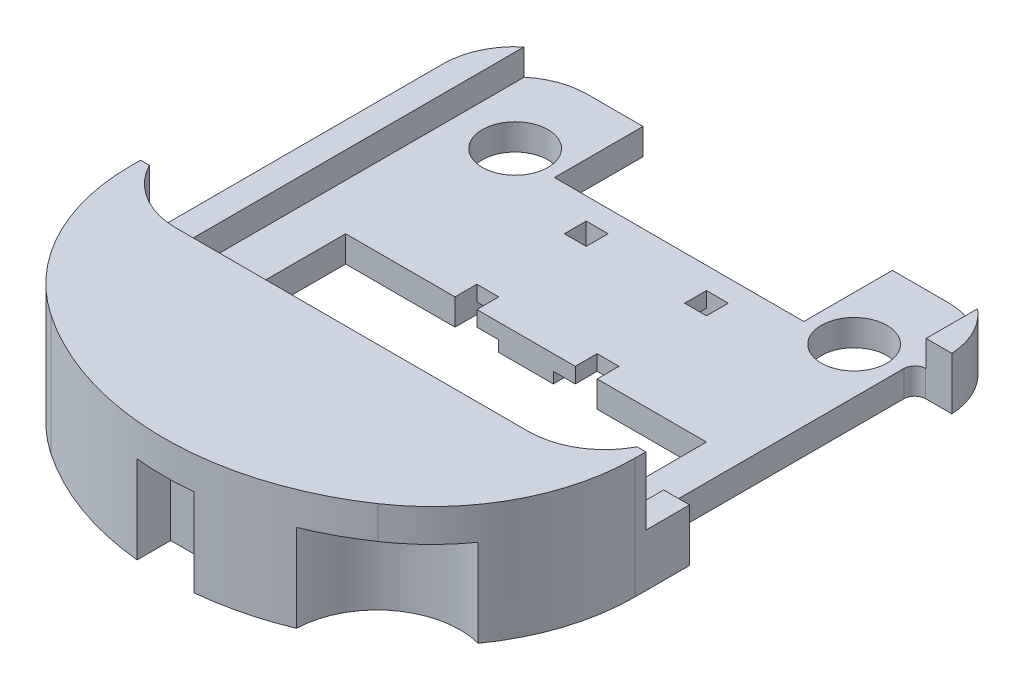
SolidWorks part; units mm, degrees
other "<拾色手电主体（1）>-<凸台-拉伸6>"
ref_plane "前视基准面" through (0, 0, 0) normal (0, 0, 1) x (1, 0, 0)
ref_plane "上视基准面" through (0, 0, 0) normal (0, 1, 0) x (1, 0, 0)
ref_plane "右视基准面" through (0, 0, 0) normal (1, 0, 0) x (0, 0, -1)
inserted part "拾色手电主体（1）"
ref_plane "基准面2" through (0, 9.5933, 0) normal (0, 1, 0) x (1, 0, 0)
sketch "草图3" plane through (0, 9.5933, 0) normal (0, 1, 0) x (1, 0, 0)
  line L0 (112.5486, 176.5566) -> (96.0486, 176.5566) construction
  line L1 (92.5486, 173.0566) -> (92.5486, 158.7494) construction
  line L2 (116.0486, 158.7494) -> (116.0486, 173.0566) construction
  line L3 (112.5486, 176.5566) -> (96.0486, 176.5566) construction
  line L4 (92.5486, 173.0566) -> (92.5486, 158.7494) construction
  line L5 (116.0486, 158.7494) -> (116.0486, 173.0566) construction
  line L6 (108.7986, 175.3066) -> (108.7986, 176.5566) construction
  line L7 (108.7986, 175.3066) -> (99.7986, 175.3066) construction
  line L8 (99.7986, 175.3066) -> (99.7986, 176.5566) construction
  line L12 (108.7986, 175.3066) -> (108.7986, 176.5566) construction
  line L13 (108.7986, 175.3066) -> (99.7986, 175.3066) construction
  line L14 (99.7986, 175.3066) -> (99.7986, 176.5566) construction
  line L15 (105.2986, 148.5937) -> (105.2986, 150.0566) construction
  line L16 (105.2986, 150.0566) -> (103.2986, 150.0566) construction
  line L17 (103.2986, 150.0566) -> (103.2986, 148.5937) construction
  circle A0 centre (104.2986, 168.3066) radius 4 construction
  circle A1 centre (112.0486, 172.5566) radius 2 construction
  circle A2 centre (96.5486, 172.5566) radius 2 construction
  arc A3 (96.0486, 176.5566) -> (92.5486, 173.0566) centre (96.0486, 173.0566) ccw construction
  arc A4 (92.5486, 158.7494) -> (96.7049, 150.8948) centre (102.0486, 158.7494) ccw construction
  arc A5 (96.7049, 150.8948) -> (111.8924, 150.8948) centre (104.2986, 162.0566) ccw construction
  arc A6 (111.8924, 150.8948) -> (116.0486, 158.7494) centre (106.5486, 158.7494) ccw construction
  arc A7 (116.0486, 173.0566) -> (112.5486, 176.5566) centre (112.5486, 173.0566) ccw construction
  circle A8 centre (104.2986, 168.3066) radius 4 construction
  circle A9 centre (112.0486, 172.5566) radius 2 construction
  circle A10 centre (96.5486, 172.5566) radius 2 construction
  arc A11 (96.0486, 176.5566) -> (92.5486, 173.0566) centre (96.0486, 173.0566) ccw construction
  arc A12 (92.5486, 158.7494) -> (96.7049, 150.8948) centre (102.0486, 158.7494) ccw construction
  arc A13 (96.7049, 150.8948) -> (111.8924, 150.8948) centre (104.2986, 162.0566) ccw construction
  arc A14 (111.8924, 150.8948) -> (116.0486, 158.7494) centre (106.5486, 158.7494) ccw construction
  arc A15 (116.0486, 173.0566) -> (112.5486, 176.5566) centre (112.5486, 173.0566) ccw construction
  arc A16 (115.0456, 152.5808) -> (109.7951, 148.6388) centre (113.1491, 149.6392) ccw construction
  arc A17 (115.0456, 152.5808) -> (109.7951, 148.6388) centre (113.1491, 149.6392) ccw construction
sketch "草图4" plane through (0, 9.5933, 0) normal (0, 1, 0) x (1, 0, 0)
  line L0 (92.5486, 173.0566) -> (92.5486, 158.7494) construction
  line L1 (116.0486, 158.7494) -> (116.0486, 173.0566) construction
  line L2 (112.5486, 176.5566) -> (96.0486, 176.5566) construction
  line L3 (92.5486, 173.0566) -> (92.5486, 158.7494) construction
  line L4 (116.0486, 158.7494) -> (116.0486, 173.0566) construction
  line L5 (112.5486, 176.5566) -> (96.0486, 176.5566) construction
  line L6 (92.7486, 173.0566) -> (92.7486, 158.7494)
  line L7 (115.8486, 158.7494) -> (115.8486, 173.0566)
  line L8 (112.5486, 176.3566) -> (96.0486, 176.3566)
  arc A0 (92.5486, 158.7494) -> (96.7049, 150.8948) centre (102.0486, 158.7494) ccw construction
  arc A1 (96.7049, 150.8948) -> (111.8924, 150.8948) centre (104.2986, 162.0566) ccw construction
  arc A2 (111.8924, 150.8948) -> (116.0486, 158.7494) centre (106.5486, 158.7494) ccw construction
  arc A3 (116.0486, 173.0566) -> (112.5486, 176.5566) centre (112.5486, 173.0566) ccw construction
  arc A4 (96.0486, 176.5566) -> (92.5486, 173.0566) centre (96.0486, 173.0566) ccw construction
  arc A5 (92.5486, 158.7494) -> (96.7049, 150.8948) centre (102.0486, 158.7494) ccw construction
  arc A6 (96.7049, 150.8948) -> (111.8924, 150.8948) centre (104.2986, 162.0566) ccw construction
  arc A7 (111.8924, 150.8948) -> (116.0486, 158.7494) centre (106.5486, 158.7494) ccw construction
  arc A8 (116.0486, 173.0566) -> (112.5486, 176.5566) centre (112.5486, 173.0566) ccw construction
  arc A9 (96.0486, 176.5566) -> (92.5486, 173.0566) centre (96.0486, 173.0566) ccw construction
  arc A10 (96.0486, 176.3566) -> (92.7486, 173.0566) centre (96.0486, 173.0566) ccw
  arc A11 (92.7486, 158.7494) -> (96.8174, 151.0602) centre (102.0486, 158.7494) ccw
  arc A12 (96.8174, 151.0602) -> (111.7799, 151.0602) centre (104.2986, 162.0566) ccw
  arc A13 (111.7799, 151.0602) -> (115.8486, 158.7494) centre (106.5486, 158.7494) ccw
  arc A14 (115.8486, 173.0566) -> (112.5486, 176.3566) centre (112.5486, 173.0566) ccw
  dimension "D1" = 0.2
extrude "凸台-拉伸1" add sketch "草图4" along normal blind 5.5 separate body
sketch "草图5" plane through (0, 15.0933, 0) normal (0, 1, 0) x (1, 0, 0)
  circle A0 centre (96.5486, 172.5566) radius 1.5
  circle A1 centre (112.0486, 172.5566) radius 1.5
  dimension "D1" = 3
  dimension "D2" = 3
extrude "切除-拉伸1" cut sketch "草图5" against normal up to next
sketch "草图6" plane through (0, 15.0933, 0) normal (0, 1, 0) x (1, 0, 0)
  line L0 (115.8486, 158.7494) -> (115.8486, 173.0566) construction
  line L3 (96.2486, 157.3566) -> (112.3486, 157.3566)
  line L5 (112.5486, 176.3566) -> (96.0486, 176.3566) construction
  line L6 (92.7486, 173.0566) -> (92.7486, 158.7494) construction
  line L8 (115.8486, 160.8566) -> (115.8486, 173.0566)
  line L9 (112.5486, 176.3566) -> (96.0486, 176.3566)
  line L10 (92.7486, 173.0566) -> (92.7486, 160.8566)
  arc A0 (92.7486, 160.8566) -> (96.2486, 157.3566) centre (96.2486, 160.8566) ccw
  arc A1 (112.3486, 157.3566) -> (115.8486, 160.8566) centre (112.3486, 160.8566) ccw
  arc A4 (115.8486, 173.0566) -> (112.5486, 176.3566) centre (112.5486, 173.0566) ccw construction
  arc A5 (96.0486, 176.3566) -> (92.7486, 173.0566) centre (96.0486, 173.0566) ccw construction
  arc A6 (115.8486, 173.0566) -> (112.5486, 176.3566) centre (112.5486, 173.0566) ccw
  arc A7 (96.0486, 176.3566) -> (92.7486, 173.0566) centre (96.0486, 173.0566) ccw
  point P0 (104.2986, 166.8566)
  dimension "D4" = 3.5
extrude "切除-拉伸2" cut sketch "草图6" against normal blind 4.3
sketch "草图7" plane through (0, 10.7933, 0) normal (0, 1, 0) x (1, 0, 0)
  line L0 (92.7486, 173.0566) -> (92.7486, 160.8566)
  line L3 (93.9314, 172.8538) -> (93.9314, 158.384)
  line L5 (93.9314, 158.384) -> (93.9314, 158.2336)
  line L6 (93.9314, 172.8538) -> (93.9314, 175.5879)
  arc A1 (92.7486, 160.8566) -> (96.2486, 157.3566) centre (96.2486, 160.8566) ccw construction
  arc A3 (92.7486, 160.8566) -> (93.9314, 158.2336) centre (96.2486, 160.8566) ccw
  arc A5 (96.0486, 176.3566) -> (92.7486, 173.0566) centre (96.0486, 173.0566) ccw construction
  arc A6 (93.9314, 175.5879) -> (92.7486, 173.0566) centre (96.0486, 173.0566) ccw
  dimension "D1" = 1.2
extrude "凸台-拉伸2" add sketch "草图7" along normal blind 1.2
ref_plane "基准面3" through (104.2986, 0, 0) normal (-1, 0, 0) x (0, 0, 1)
mirror "镜向1" about plane through (104.2986, 0, 0) normal (-1, 0, 0) of "凸台-拉伸2"
sketch "草图8" plane through (0, 9.5933, 0) normal (0, -1, 0) x (1, 0, 0)
  line L4 (108.7986, -175.3066) -> (108.7986, -176.5566) construction
  line L5 (108.7986, -175.3066) -> (99.7986, -175.3066) construction
  line L6 (99.7986, -175.3066) -> (99.7986, -176.5566) construction
  line L7 (112.5486, -176.5566) -> (96.0486, -176.5566) construction
  line L8 (105.2986, -148.5937) -> (105.2986, -150.0566) construction
  line L9 (105.2986, -150.0566) -> (103.2986, -150.0566) construction
  line L10 (103.2986, -150.0566) -> (103.2986, -148.5937) construction
  line L11 (108.7986, -175.3066) -> (108.7986, -176.5566) construction
  line L12 (108.7986, -175.3066) -> (99.7986, -175.3066) construction
  line L13 (99.7986, -175.3066) -> (99.7986, -176.5566) construction
  line L14 (108.7986, -176.5566) -> (99.7986, -176.5566) construction
  line L15 (105.2986, -148.5937) -> (105.2986, -150.0566) construction
  line L16 (105.2986, -150.0566) -> (103.2986, -150.0566) construction
  line L17 (103.2986, -150.0566) -> (103.2986, -148.5937) construction
  line L18 (105.5986, -148.318) -> (105.5986, -150.3566)
  line L19 (105.5986, -150.3566) -> (102.9986, -150.3566)
  line L20 (102.9986, -150.3566) -> (102.9986, -148.318)
  line L21 (109.9986, -174.1066) -> (109.9986, -177.7566)
  line L22 (109.9986, -177.7566) -> (98.5986, -177.7566)
  line L23 (98.5986, -174.1066) -> (98.5986, -177.7566)
  line L24 (109.9986, -174.1066) -> (98.5986, -174.1066)
  arc A0 (116.0486, -158.7494) -> (111.8924, -150.8948) centre (106.5486, -158.7494) ccw construction
  arc A1 (109.7951, -148.6388) -> (115.0456, -152.5808) centre (113.1491, -149.6392) ccw construction
  arc A2 (111.8924, -150.8948) -> (96.7049, -150.8948) centre (104.2986, -162.0566) ccw construction
  arc A3 (114.114, -153.0036) -> (109.6516, -149.7705) centre (106.5486, -158.7494) ccw construction
  arc A4 (109.6516, -149.7705) -> (114.114, -153.0036) centre (113.1491, -149.6392) ccw construction
  arc A5 (105.2986, -148.5937) -> (103.2986, -148.5937) centre (104.2986, -162.0566) ccw construction
  arc A6 (105.5986, -148.318) -> (102.9986, -148.318) centre (104.2986, -162.0566) ccw
  arc A7 (114.594, -153.1538) -> (109.3593, -149.3611) centre (106.5486, -158.7494) ccw
  arc A8 (109.3593, -149.3611) -> (114.594, -153.1538) centre (113.1491, -149.6392) ccw
  dimension "D1" = 0.3
  dimension "D2" = 1.2
extrude "切除-拉伸3" cut sketch "草图8" against normal offset from surface (4 mm away) 1.5
sketch "草图9" plane through (0, 9.5933, 0) normal (0, -1, 0) x (-1, 0, 0)
  line L1 (-107.5486, 171.3066) -> (-101.0486, 171.3066)
  line L2 (-107.5486, 171.3066) -> (-107.5486, 165.3066)
  line L3 (-107.5486, 165.3066) -> (-101.0486, 165.3066)
  line L4 (-101.0486, 171.3066) -> (-101.0486, 165.3066)
  line L5 (-107.5486, 171.3066) -> (-101.0486, 165.3066) construction
  line L6 (-107.5486, 165.3066) -> (-101.0486, 171.3066) construction
  point P0 (-104.2986, 168.3066)
  dimension "D1" = 6.5
  dimension "D2" = 6
extrude "切除-拉伸4" cut sketch "草图9" against normal blind 0.5
sketch "草图10" plane through (0, 10.0933, 0) normal (0, -1, 0) x (1, 0, 0)
  line L1 (107.5486, -171.3066) -> (106.5486, -171.3066)
  line L2 (107.5486, -171.3066) -> (107.5486, -170.3066)
  line L3 (107.5486, -170.3066) -> (106.5486, -170.3066)
  line L4 (106.5486, -171.3066) -> (106.5486, -170.3066)
  line L5 (101.0486, -171.3066) -> (102.0486, -171.3066)
  line L6 (101.0486, -171.3066) -> (101.0486, -170.3066)
  line L7 (101.0486, -170.3066) -> (102.0486, -170.3066)
  line L8 (102.0486, -171.3066) -> (102.0486, -170.3066)
  line L9 (101.0486, -165.3066) -> (102.0486, -165.3066)
  line L10 (101.0486, -165.3066) -> (101.0486, -166.3066)
  line L11 (101.0486, -166.3066) -> (102.0486, -166.3066)
  line L12 (102.0486, -165.3066) -> (102.0486, -166.3066)
  line L13 (107.5486, -165.3066) -> (106.5486, -165.3066)
  line L14 (107.5486, -165.3066) -> (107.5486, -166.3066)
  line L15 (107.5486, -166.3066) -> (106.5486, -166.3066)
  line L16 (106.5486, -165.3066) -> (106.5486, -166.3066)
  dimension "D1" = 1
  dimension "D2" = 1
extrude "切除-拉伸5" cut sketch "草图10" against normal up to next
sketch "草图12" plane through (0, 10.0933, 0) normal (0, -1, 0) x (1, 0, 0)
  line L0 (107.5486, -170.3066) -> (107.5486, -166.3066) construction
  line L1 (101.0486, -167.6816) -> (107.5486, -167.6816)
  line L2 (101.0486, -167.6816) -> (101.0486, -168.9316)
  line L3 (101.0486, -168.9316) -> (107.5486, -168.9316)
  line L4 (107.5486, -167.6816) -> (107.5486, -168.9316)
  line L5 (101.0486, -167.6816) -> (107.5486, -168.9316) construction
  line L6 (101.0486, -168.9316) -> (107.5486, -167.6816) construction
  line L7 (104.2986, 3.025) -> (104.2986, -3.025) construction
  line L8 (103.0486, -165.3066) -> (105.5486, -165.3066)
  line L9 (103.0486, -165.3066) -> (103.0486, -166.3066)
  line L10 (103.0486, -166.3066) -> (105.5486, -166.3066)
  line L11 (105.5486, -165.3066) -> (105.5486, -166.3066)
  line L12 (103.0486, -165.3066) -> (105.5486, -166.3066) construction
  line L13 (103.0486, -166.3066) -> (105.5486, -165.3066) construction
  line L14 (106.5486, -165.3066) -> (102.0486, -165.3066) construction
  line L15 (101.0486, -168.3066) -> (107.5486, -168.3066) construction
  line L16 (103.0486, -170.3066) -> (105.5486, -171.3066) construction
  line L17 (103.0486, -171.3066) -> (105.5486, -170.3066) construction
  line L18 (105.5486, -171.3066) -> (105.5486, -170.3066)
  line L19 (103.0486, -170.3066) -> (105.5486, -170.3066)
  line L20 (103.0486, -171.3066) -> (103.0486, -170.3066)
  line L21 (103.0486, -171.3066) -> (105.5486, -171.3066)
  point P0 (104.2986, -168.3066)
  point P8 (104.2986, -165.8066)
  point P24 (104.2986, -170.8066)
  dimension "D1" = 1.25
  dimension "D2" = 2.5
  dimension "D3" = 1
extrude "凸台-拉伸3" add sketch "草图12" along normal up to surface (0.5 mm away)
sketch "草图13" plane through (0, 10.7933, 0) normal (0, 1, 0) x (1, 0, 0)
  line L0 (104.2986, 3.025) -> (104.2986, -3.025) construction
  line L1 (96.0486, 165.3066) -> (112.5486, 165.3066)
  line L2 (96.0486, 165.3066) -> (96.0486, 155.3066)
  line L3 (96.0486, 155.3066) -> (112.5486, 155.3066)
  line L4 (112.5486, 165.3066) -> (112.5486, 155.3066)
  line L5 (96.0486, 165.3066) -> (112.5486, 155.3066) construction
  line L6 (96.0486, 155.3066) -> (112.5486, 165.3066) construction
  point P0 (104.2986, 160.3066)
  point P8 (104.2986, 160.3066)
  dimension "D1" = 16.5
  dimension "D2" = 10
  dimension "D3" = 8
extrude "切除-拉伸6" cut sketch "草图13" against normal up to next
sketch "草图14" plane through (0, 9.5933, 0) normal (0, 1, 0) x (1, 0, 0)
  line L1 (80.8314, 188.9573) -> (123.4229, 188.9573)
  line L2 (80.8314, 188.9573) -> (80.8314, 139.6609)
  line L3 (80.8314, 139.6609) -> (123.4229, 139.6609)
  line L4 (123.4229, 188.9573) -> (123.4229, 139.6609)
extrude "切除-拉伸8" cut sketch "草图14" against normal up to vertex
sketch "草图15" plane through (0, 9.5933, 0) normal (0, -1, 0) x (1, 0, 0)
  line L0 (98.5986, -174.1066) -> (109.9986, -174.1066)
  line L1 (98.5986, -174.1066) -> (98.5986, -172.3066)
  line L2 (109.9986, -174.1066) -> (109.9986, -172.3066)
  line L3 (98.5986, -172.3066) -> (109.9986, -172.3066)
  line L5 (105.5486, -171.3066) -> (106.5486, -171.3066) construction
  dimension "D1" = 1
extrude "切除-拉伸9" cut sketch "草图15" against normal up to next
sketch "草图16" plane through (0, 15.0933, 0) normal (0, 1, 0) x (1, 0, 0)
  line L6 (93.1486, 159.2318) -> (92.7486, 159.2318)
  line L7 (115.4486, 159.2318) -> (115.8486, 159.2318)
  line L8 (92.7486, 160.8566) -> (92.7486, 158.7494) construction
  line L9 (115.8486, 158.7494) -> (115.8486, 160.8566) construction
  line L10 (92.7486, 160.8566) -> (92.7486, 159.2318)
  line L11 (115.8486, 159.2318) -> (115.8486, 160.8566)
  arc A1 (114.6659, 158.2336) -> (115.8486, 160.8566) centre (112.3486, 160.8566) ccw construction
  arc A2 (92.7486, 160.8566) -> (93.9314, 158.2336) centre (96.2486, 160.8566) ccw construction
  arc A11 (115.4486, 159.2318) -> (115.8486, 160.8566) centre (112.3486, 160.8566) ccw
  arc A12 (92.7486, 160.8566) -> (93.1486, 159.2318) centre (96.2486, 160.8566) ccw
  dimension "D1" = 0.4
  dimension "D2" = 0.4
extrude "切除-拉伸10" cut sketch "草图16" against normal up to surface (3.1 mm away)
sketch "草图17" plane through (0, 10.7933, 0) normal (0, -1, 0) x (1, 0, 0)
  line L0 (96.0486, -155.3066) -> (112.5486, -155.3066)
  line L1 (96.0486, -155.3066) -> (96.0486, -157.436)
  line L2 (112.5486, -155.3066) -> (112.5486, -157.436)
  line L3 (96.0486, -157.436) -> (112.5486, -157.436)
extrude "切除-拉伸11" cut sketch "草图17" against normal up to surface (1.2 mm away)
sketch "草图18" plane through (0, 11.9933, 0) normal (0, 1, 0) x (1, 0, 0)
  line L1 (115.8486, 173.2318) -> (114.1486, 173.2318)
  line L2 (115.8486, 173.2318) -> (115.8486, 161.2318)
  line L3 (115.8486, 161.2318) -> (114.1486, 161.2318)
  line L4 (114.1486, 173.2318) -> (114.1486, 161.2318)
  point P6 (112.0486, 172.5566)
  dimension "D1" = 1.7
  dimension "D2" = 12
  dimension "D3" = 2
extrude "切除-拉伸12" cut sketch "草图18" against normal up to next
fillet "圆角1" radius 0.5 2 edges at (114.1486, 10.1933, -173.2318) (114.1486, 10.1933, -161.2318)
